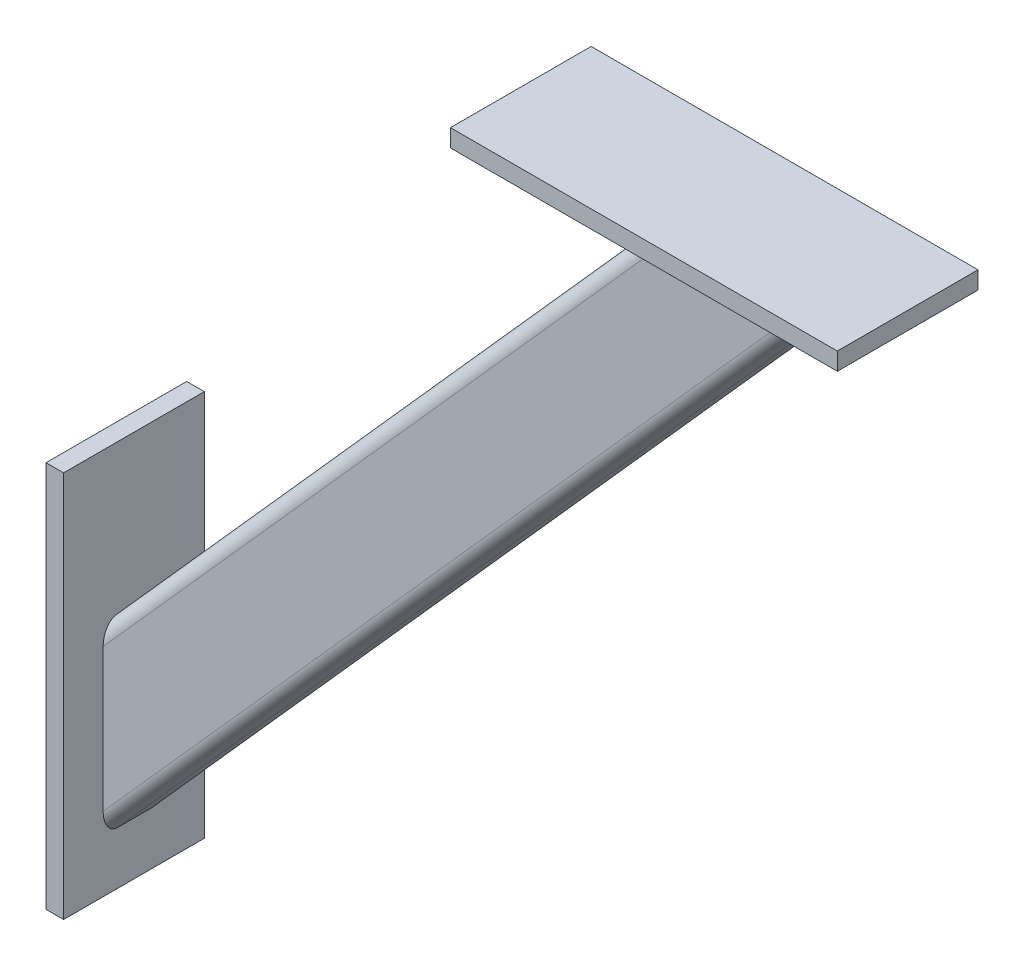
SolidWorks part; units mm, degrees
ref_plane "Plan1" through (0, 0, 0) normal (0, 0, 1) x (1, 0, 0)
ref_plane "cadre" through (0, 0, 0) normal (0, 1, 0) x (1, 0, 0)
ref_plane "pied" through (0, 0, 0) normal (1, 0, 0) x (0, 0, -1)
sketch "Esquisse1" plane through (0, 0, 0) normal (0, 0, 1) x (1, 0, 0)
  line L0 (450, 0) -> (230, 0)
  line L1 (44, 0) -> (-44, 0) construction
  line L2 (0, -280) -> (0, -500)
  line L3 (0, -44) -> (0, 44) construction
  line L4 (415.2969, 37.3257) -> (-33.2685, -465.9429)
  line L5 (420, -10) -> (10, -470) construction
  line L6 (10, -470) -> (0, -470) construction
  line L7 (420, -10) -> (420, 0) construction
  point P10 (382.0284, 0)
  point P14 (0, -428.6172)
  dimension "D1" = 220
  dimension "D2" = 450
  dimension "D3" = 500
  dimension "D4" = 71.3828
  dimension "D5" = 67.9716
  dimension "D6" = 50
  dimension "D7" = 50
  dimension "D8" = 35
  dimension "D9" = 30
  dimension "D10" = 30
  dimension "D11" = 10
sketch "Esquisse2" plane through (0, 0, 0) normal (0, 0, 1) x (1, 0, 0)
  line L0 (0, -280) -> (0, -500) construction
  line L1 (450, 0) -> (230, 0) construction
  line L2 (0, -280) -> (0, -500)
  line L3 (450, 0) -> (230, 0)
extrude "Extru.-Mince1" add sketch "Esquisse2" along normal mid plane 80 thin
hole_wizard "Diamètre du perçage Ø12.0 (12)1" positions "Esquisse3" profile "Esquisse4" hole size "Ø12.0" standard "ISO"
sketch "Esquisse3" plane through (0, 0, 0) normal (0, 1, 0) x (1, 0, 0)
  line L0 (280, 0) -> (340, 0) construction
  line L1 (450, 0) -> (230, 0) construction
  line L2 (340, 0) -> (340, 40) construction
  line L3 (450, 40) -> (230, 40) construction
  point P0 (250, 28)
  point P14 (250, -28)
  point P16 (430, 28)
  point P17 (430, -28)
  dimension "D1" = 56
  dimension "D2" = 180
sketch "Esquisse4" plane through (250, 0, -28) normal (1, 0, 0) x (0, 0, 1)
  line L0 (0, 0) -> (0, 500)
  line L1 (0, 500) -> (6, 500)
  line L2 (6, 500) -> (6, 0)
  line L5 (6, 0) -> (0, 0)
  line L11 (0, -6.35) -> (0, 107.95) construction
  dimension "Diamètre du perçage jusqu'au prochain" = 12
  dimension "Profondeur du perçage jusqu'au prochain" = 500
hole_wizard "Diamètre du perçage Ø12.0 (12)2" positions "Esquisse5" profile "Esquisse6" hole size "Ø12.0" standard "ISO"
sketch "Esquisse5" plane through (0, 0, 0) normal (-1, 0, 0) x (0, 0, 1)
  line L0 (0, -280) -> (0, -390) construction
  line L1 (40, -280) -> (-40, -280) construction
  line L2 (0, 37.3257) -> (0, -465.9429) construction
  line L3 (0, -390) -> (40, -390) construction
  line L4 (40, -280) -> (40, -500) construction
  point P0 (28, -300)
  point P16 (-28, -300)
  point P18 (28, -480)
  point P19 (-28, -480)
  dimension "D1" = 56
  dimension "D2" = 180
sketch "Esquisse6" plane through (0, -300, 28) normal (0, 1, 0) x (0, 0, 1)
  line L0 (0, 0) -> (0, 450)
  line L1 (0, 450) -> (6, 450)
  line L2 (6, 450) -> (6, 0)
  line L5 (6, 0) -> (0, 0)
  line L11 (0, -6.35) -> (0, 107.95) construction
  dimension "Diamètre du perçage jusqu'au prochain" = 12
  dimension "Profondeur du perçage jusqu'au prochain" = 450
other "Tube rectangulaire °70X35X3(1)"
ref_plane "Plan4" through (415.2969, 37.3257, 0) normal (-0.6654, -0.7465, 0) x (0.7465, -0.6654, 0)
sketch "tube 70x35x3" plane through (415.2969, 37.3257, 0) normal (-0.6654, -0.7465, 0) x (0.7465, -0.6654, 0)
  line L0 (-27, 13.5) -> (27, 13.5)
  line L1 (-27, 17.5) -> (27, 17.5)
  line L2 (-35, 9.5) -> (-35, -9.5)
  line L3 (-27, -17.5) -> (27, -17.5)
  line L4 (35, 9.5) -> (35, -9.5)
  line L5 (31, 9.5) -> (31, -9.5)
  line L6 (-27, -13.5) -> (27, -13.5)
  line L7 (-31, 9.5) -> (-31, -9.5)
  line L8 (-27, 9.5) -> (-29.8284, 12.3284) construction
  line L9 (-29.8284, 12.3284) -> (-32.6569, 15.1569) construction
  line L10 (-35, 0) -> (35, 0) construction
  line L11 (0, 17.5) -> (0, -17.5) construction
  arc A0 (-27, 17.5) -> (-35, 9.5) centre (-27, 9.5) ccw
  arc A1 (-35, -9.5) -> (-27, -17.5) centre (-27, -9.5) ccw
  arc A2 (27, -17.5) -> (35, -9.5) centre (27, -9.5) ccw
  arc A3 (27, 17.5) -> (35, 9.5) centre (27, 9.5) cw
  arc A4 (27, 13.5) -> (31, 9.5) centre (27, 9.5) cw
  arc A5 (27, -13.5) -> (31, -9.5) centre (27, -9.5) ccw
  arc A6 (-31, -9.5) -> (-27, -13.5) centre (-27, -9.5) ccw
  arc A7 (-27, 13.5) -> (-31, 9.5) centre (-27, 9.5) ccw
  point P24 (35, 17.5)
  point P25 (35, -17.5)
  point P26 (-35, -17.5)
  point P27 (-35, 17.5)
  point P31 (0, 0)
  dimension "a" = 70
  dimension "b" = 35
  dimension "e" = 4
sketch "Esquisse8" plane through (0, 0, 0) normal (0, 0, 1) x (1, 0, 0)
  line L0 (450, -10) -> (230, -10) construction
  line L1 (10, -10) -> (450, -10)
  line L2 (10, -10) -> (10, -500)
  line L3 (10, -500) -> (450, -500)
  line L4 (450, -10) -> (450, -500)
  line L5 (10, -280) -> (10, -500) construction
  line L6 (10, -500) -> (0, -500) construction
  line L7 (450, 0) -> (450, -10) construction
extrude "Enlèv. mat.-Extru.1" cut sketch "Esquisse8" against normal through all both and the other way through all flip side to cut
